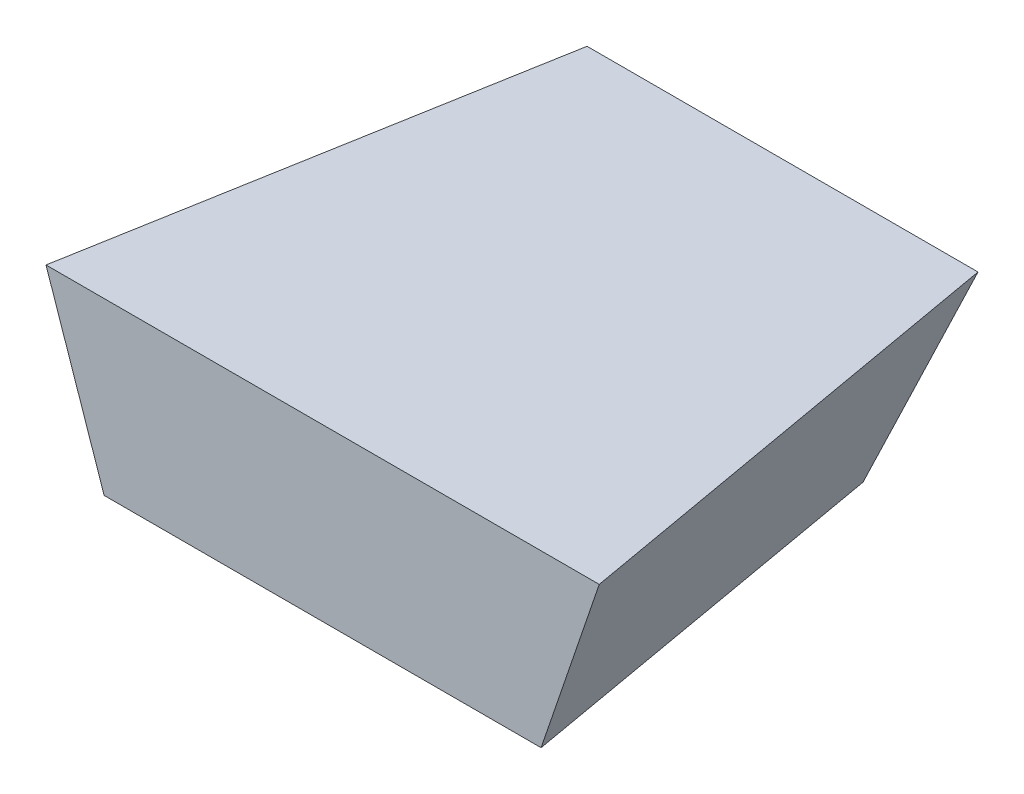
SolidWorks part; units mm, degrees
ref_plane "Front Plane" through (0, 0, 0) normal (0, 0, 1) x (1, 0, 0)
ref_plane "Top Plane" through (0, 0, 0) normal (0, 1, 0) x (1, 0, 0)
ref_plane "Right Plane" through (0, 0, 0) normal (1, 0, 0) x (0, 0, -1)
sketch "Sketch1" plane through (0, 0, 0) normal (0, 1, 0) x (1, 0, 0)
  line L0 (-60.325, 0) -> (60.325, 0)
  line L1 (60.325, 0) -> (41.275, 107.95)
  line L2 (41.275, 107.95) -> (-41.275, 107.95)
  line L3 (-41.275, 107.95) -> (-60.325, 0)
  line L4 (0, 0) -> (0, 107.95) construction
  dimension "D1" = 120.65
  dimension "D2" = 82.55
  dimension "D3" = 107.95
sketch "Sketch2" plane through (0, 0, 0) normal (1, 0, 0) x (0, 0, -1)
  line L0 (107.95, 0) -> (127, 47.0929)
  line L1 (127, 47.0929) -> (0, 47.0929)
  line L2 (0, 0) -> (0, 47.0929)
  dimension "D3" = 50.8
  dimension "D4" = 127
ref_plane "Plane1" through (0, 47.0929, 0) normal (0, 1, 0) x (1, 0, 0)
sketch "Sketch3" plane through (0, 47.0929, 0) normal (0, 1, 0) x (1, 0, 0)
  line L0 (-53.975, 127) -> (53.975, 127)
  line L1 (53.975, 127) -> (76.3868, 0)
  line L3 (-53.975, 127) -> (-76.3868, 0)
  line L4 (-76.3868, 0) -> (76.3868, 0)
  line L7 (60.325, 0) -> (41.275, 107.95) construction
  line L8 (-41.275, 107.95) -> (-60.325, 0) construction
  line L9 (-60.325, 0) -> (60.325, 0) construction
  dimension "D1" = 107.95
loft "Loft1" add profiles "Sketch1", "Sketch3"
sketch "Rip Sketch" plane through (0, 0, 0) normal (0, 0, 1) x (1, 0, 0)
  line L0 (0, 0) -> (0, 47.0929)
  line L1 (-76.3868, 47.0929) -> (76.3868, 47.0929) construction
